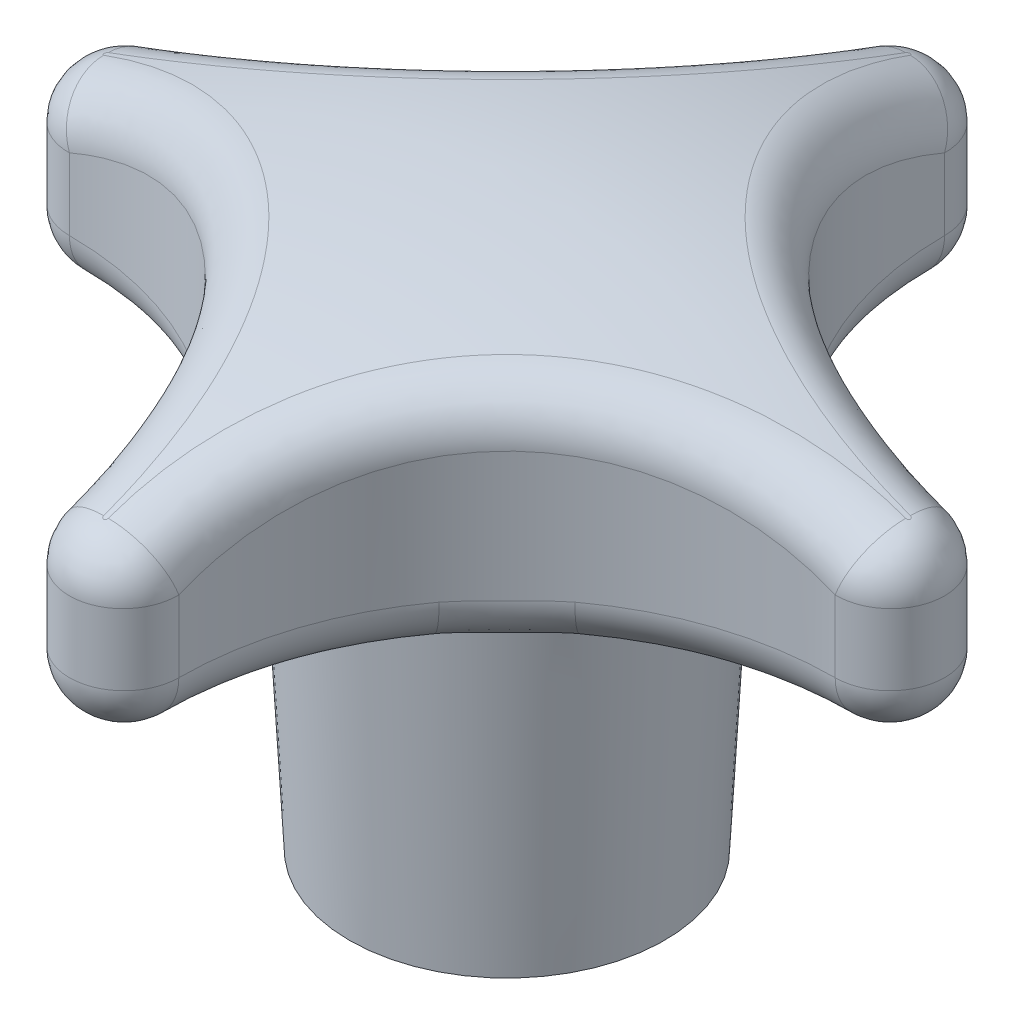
SolidWorks part; units mm, degrees
ref_plane "Front Plane" through (0, 0, 0) normal (0, 0, 1) x (1, 0, 0)
ref_plane "Top Plane" through (0, 0, 0) normal (0, 1, 0) x (1, 0, 0)
ref_plane "Right Plane" through (0, 0, 0) normal (1, 0, 0) x (0, 0, -1)
sketch "Sketch1" plane through (0, 0, 0) normal (0, 1, 0) x (1, 0, 0)
  circle A0 centre (0, 0) radius 9
  dimension "D1" = 18
extrude "Extrude1" add sketch "Sketch1" against normal blind 18
draft "Draft1" type of draft neutral plane draft angle 3 faces to draft 1 parameters "D1"=3
sketch "Sketch2" plane through (0, 0, 0) normal (0, 0, 1) x (1, 0, 0)
  line L0 (0, 0) -> (-25, 0)
  line L1 (-25, 0) -> (-25, 9.1)
  line L2 (0, 0) -> (0, 50000) construction
  line L3 (0, 14) -> (20.2547, 14) construction
  line L4 (0, 0) -> (0, 14)
  arc A0 (0, 14) -> (-25, 9.1) centre (0, -52.2255) ccw
revolve "Revolve1" add sketch "Sketch2" angle 360 about L2
sketch "Sketch4" plane through (0, 0, 0) normal (0, 1, 0) x (1, 0, 0)
  line L0 (0, 0) -> (-50000, 0) construction
  line L1 (0, 0) -> (0, 50000) construction
  line L2 (-21.875, 3.125) -> (-45.9117, 3.125) construction
  line L3 (-3.125, 21.875) -> (-3.125, 40.3224) construction
  arc A0 (0, 25) -> (-3.125, 21.875) centre (0, 21.875) ccw
  arc A1 (-21.875, 3.125) -> (-25, 0) centre (-21.875, 0) ccw
  circle A2 centre (0, 0) radius 25 construction
  arc A3 (-21.875, 3.125) -> (-3.125, 21.875) centre (-21.875, 21.875) ccw
  arc A4 (0, 25) -> (-25, 0) centre (-25, 25) ccw
  point P9 (0, 25)
  point P10 (-25, 0)
  point P13 (-3.125, 21.875)
  point P14 (-21.875, 3.125)
extrude "Extrude3" cut sketch "Sketch4" along normal through all
pattern_circular "CirPattern1" count 4 over 360 about axis through (0, 0, 0) along (0, 1, 0) of "Extrude3"
fillet "Fillet2" radius 3 16 edges at (0, 0, 25) (8.6167, 0, 8.6167) (25, 0, 0) (8.6167, 0, -8.6167) (0, 0, -25) (-8.6167, 0, -8.6167) (-25, 0, 0) (-0.0002, 9.1, 25) (10.5886, 12.7826, 6.9024) (25, 9.1, 0.0002) (6.9024, 12.7826, -10.5886) (0.0002, 9.1, -25) (-10.5886, 12.7826, -6.9024) (-25, 9.1, 0.0002) (-8.6167, 0, 8.6167) (-6.9024, 12.7826, 10.5886)
sketch "Sketch6" plane through (0, -18, 0) normal (0, -1, 0) x (1, 0, 0)
  circle A0 centre (0, 0) radius 5
  dimension "D1" = 10
extrude "Extrude5" [suppressed] cut sketch "Sketch6" against normal blind 21
sketch "Sketch7" [suppressed] plane through (0, 0, 0) normal (0, 0, 1) x (1, 0, 0)
  line L0 (-0.125, 1) -> (5, 1)
  line L1 (5, -20) -> (5, 1) construction
  line L2 (5, 1) -> (-0.125, 3.9589)
  line L3 (-0.125, 3.9589) -> (-0.125, 1)
  line L4 (-5, -20) -> (5, -20) construction
revolve "Cut-Revolve1" [suppressed] cut sketch "Sketch7" angle 360 about L3
sketch "Sketch10" plane through (0, -18, 0) normal (0, -1, 0) x (1, 0, 0)
  circle A0 centre (0, 0) radius 4.25
  dimension "D1" = 8.5
extrude "Extrude8" cut sketch "Sketch10" against normal blind 21
sketch "Sketch11" plane through (0, 0, 0) normal (0, 0, 1) x (1, 0, 0)
  line L0 (0, 3) -> (4.25, 3)
  line L1 (-4.25, 3) -> (4.25, 3) construction
  line L2 (4.25, 3) -> (0, 5.4537)
  line L3 (0, 5.4537) -> (0, 3)
  dimension "D1" = 30
revolve "Cut-Revolve2" cut sketch "Sketch11" angle 360 about L3
equation "\"D2@Sketch2\" = \"D1@Sketch2\"*.65"
equation "\"D1@Sketch4\" = (\"D3@Sketch2\"*2)/8"
equation "\"D2@Sketch4\" =( \"D3@Sketch2\"*2)/8"
equation "\"D1@Sketch7\" = \"D1@Extrude5\""
